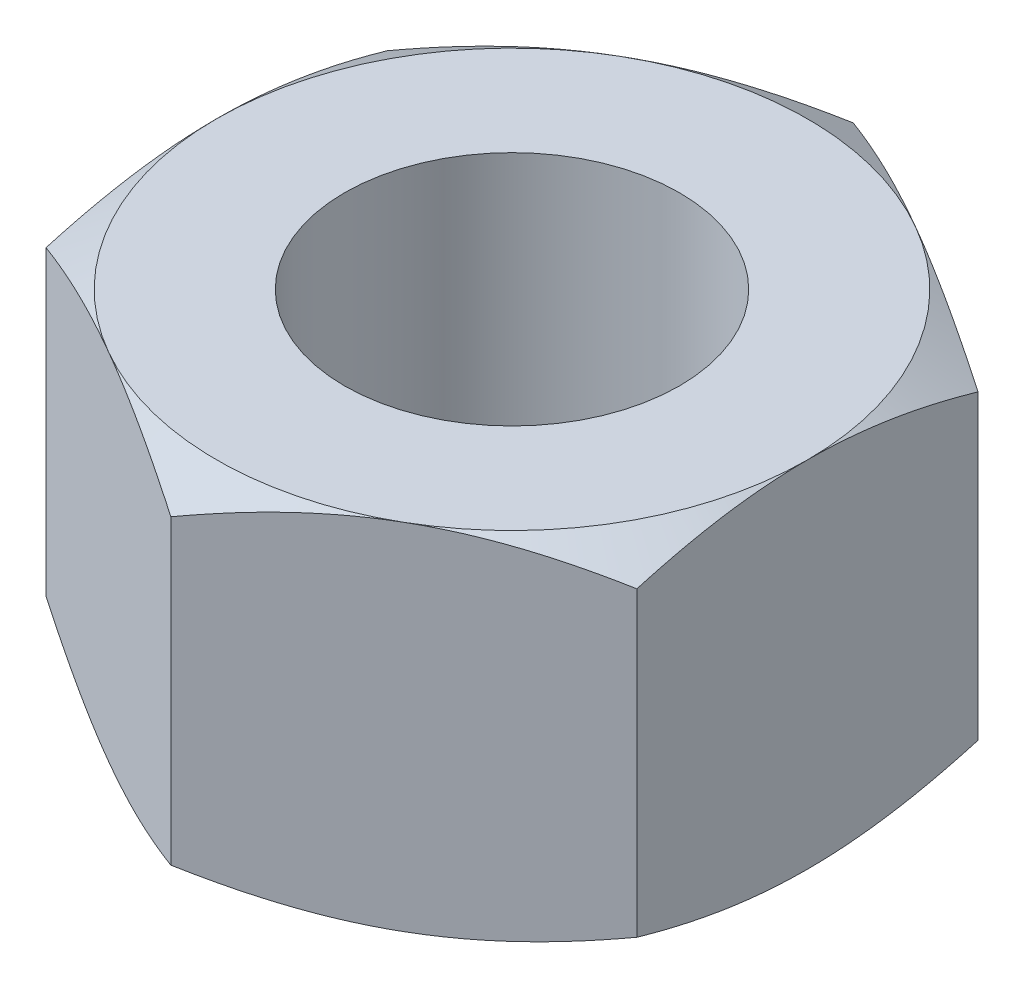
SolidWorks part; units mm, degrees
ref_plane "Front" through (0, 0, 0) normal (0, 0, 1) x (1, 0, 0)
ref_plane "Top" through (0, 0, 0) normal (0, 1, 0) x (1, 0, 0)
ref_plane "Right" through (0, 0, 0) normal (1, 0, 0) x (0, 0, -1)
sketch "Sketch1" plane through (0, 0, 0) normal (0, 1, 0) x (1, 0, 0)
  line L1 (0, 10.3923) -> (-9, 5.1962)
  line L2 (-9, 5.1962) -> (-9, -5.1962)
  line L3 (-9, -5.1962) -> (0, -10.3923)
  line L4 (0, -10.3923) -> (9, -5.1962)
  line L5 (9, -5.1962) -> (9, 5.1962)
  line L6 (9, 5.1962) -> (0, 10.3923)
  circle A0 centre (0, 0) radius 9 construction
  dimension "D1" = 18
extrude "Extrude1" add sketch "Sketch1" along normal mid plane 10.8
sketch "Sketch2" plane through (0, 5.4, 0) normal (0, 1, 0) x (1, 0, 0)
  line L0 (9, 5.1962) -> (0, 10.3923) construction
  circle A0 centre (0, 0) radius 9
extrude "Cut-Extrude1" cut sketch "Sketch2" against normal through all draft 60 flip side to cut
mirror "Mirror1" about plane through (0, 0, 0) normal (0, 1, 0) of "Cut-Extrude1"
hole_wizard "M12x1.75 Tapped Hole1" positions "Sketch3" profile "Sketch4" tap size "M12x1.75" standard "ANSI Metric"
sketch "Sketch3" plane through (0, 5.4, 0) normal (0, 1, 0) x (1, 0, 0)
  point P0 (0, 0)
sketch "Sketch4" plane through (0, 5.4, 0) normal (1, 0, 0) x (0, 0, 1)
  line L0 (0, 0) -> (0, 10.8)
  line L1 (0, 10.8) -> (5.1, 10.8)
  line L2 (5.1, 10.8) -> (5.1, 0)
  line L5 (5.1, 0) -> (0, 0)
  line L11 (0, -6.35) -> (0, 107.95) construction
  dimension "Thru Tap Drill Dia." = 10.2
  dimension "Thru Tap Drill Depth" = 10.8
